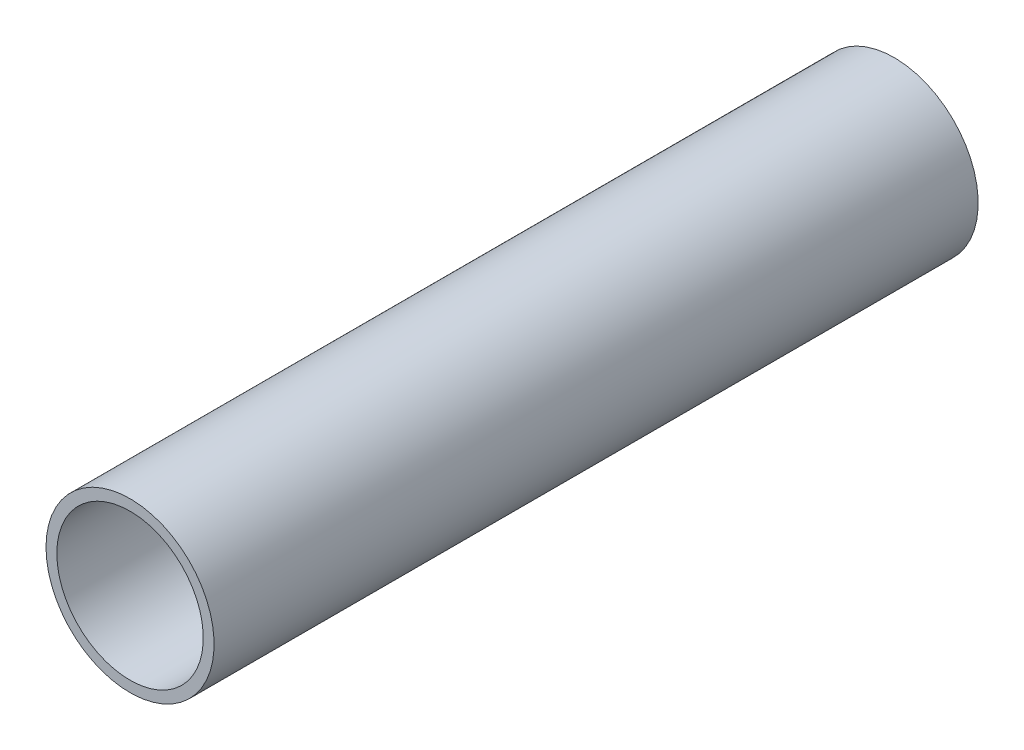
SolidWorks part; units mm, degrees
ref_plane "Front Plane" through (0, 0, 0) normal (0, 0, 1) x (1, 0, 0)
ref_plane "Top Plane" through (0, 0, 0) normal (0, 1, 0) x (1, 0, 0)
ref_plane "Right Plane" through (0, 0, 0) normal (1, 0, 0) x (0, 0, -1)
sketch "Sketch1" plane through (0, 0, 0) normal (0, 0, 1) x (1, 0, 0)
  circle A0 centre (0, 0) radius 16.764
  circle A1 centre (0, 0) radius 14.605
  dimension "D1" = 33.528
  dimension "D2" = 29.21
extrude "Boss-Extrude1" add sketch "Sketch1" along normal blind 152.4
